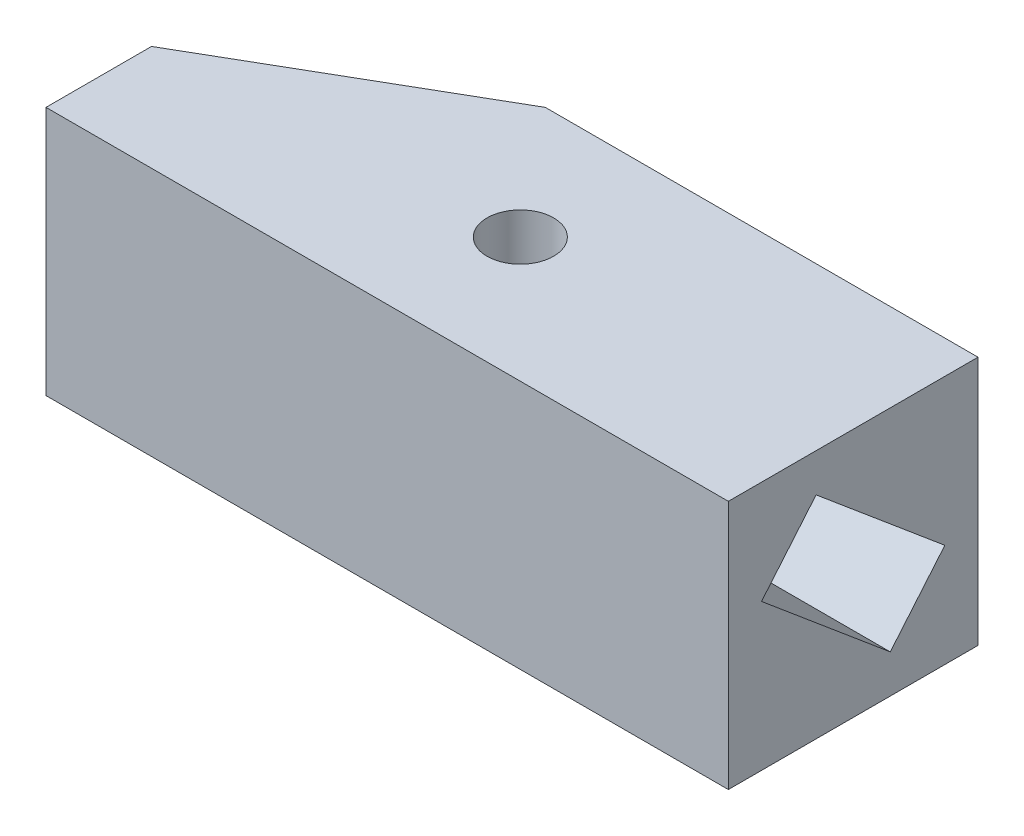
SolidWorks part; units mm, degrees
ref_plane "Спереди" through (0, 0, 0) normal (0, 0, 1) x (1, 0, 0)
ref_plane "Сверху" through (0, 0, 0) normal (0, 1, 0) x (1, 0, 0)
ref_plane "Справа" through (0, 0, 0) normal (1, 0, 0) x (0, 0, -1)
sketch "Эскиз1" plane through (0, 0, 0) normal (0, 1, 0) x (1, 0, 0)
  line L0 (-20, -15) -> (-35, -15)
  line L1 (-20, -15) -> (20, -15)
  line L2 (-35, -15) -> (-35, 15)
  line L3 (-20, 15) -> (20, 15)
  line L4 (20, -15) -> (20, 15)
  line L5 (-20, -15) -> (20, 15) construction
  line L6 (-20, 15) -> (20, -15) construction
  line L7 (-35, 15) -> (-20, 15)
  point P0 (0, 0)
  dimension "D1" = 40
  dimension "D2" = 30
  dimension "D3" = 15
extrude "Бобышка-Вытянуть1" add sketch "Эскиз1" along normal blind 30
sketch "Эскиз2" plane through (0, 30, 0) normal (0, 1, 0) x (1, 0, 0)
  line L0 (-20, -15) -> (-20, 15) construction
  circle A0 centre (-20, 0) radius 4
  dimension "D1" = 15
extrude "Вырез-Вытянуть1" cut sketch "Эскиз2" against normal through all
sketch "Эскиз5" plane through (20, 0, 0) normal (1, 0, 0) x (0, 0, -1)
  line L0 (0, 30) -> (0, 0) construction
  line L1 (-15, 30) -> (15, 0) construction
  line L2 (-15, 0) -> (15, 0) construction
  line L4 (4.4588, 4.601) -> (11.0153, 12.4147)
  line L5 (4.4588, 4.601) -> (-11.0153, 17.5853)
  line L6 (-11.0153, 17.5853) -> (-4.4588, 25.399)
  line L7 (11.0153, 12.4147) -> (-4.4588, 25.399)
  line L8 (4.4588, 4.601) -> (-4.4588, 25.399) construction
  line L9 (-11.0153, 17.5853) -> (11.0153, 12.4147) construction
  point P5 (0, 15)
  point P6 (0, 15)
  dimension "D1" = 20.2
  dimension "D2" = 10.2
  dimension "D3" = 40
extrude "Вырез-Вытянуть4" cut sketch "Эскиз5" against normal blind 25
sketch "Sketch1" plane through (-35, 0, 0) normal (-1, 0, 0) x (0, 0, 1)
  line L0 (0, 30) -> (0, 0) construction
  line L1 (-15, 30) -> (15, 30) construction
  line L3 (-15, 0) -> (15, 0)
  line L4 (-15, 0) -> (-15, 30)
  line L5 (-15, 30) -> (15, 30)
  line L6 (15, 0) -> (15, 30)
  line L7 (-15, 0) -> (15, 30) construction
  line L8 (-15, 30) -> (15, 0) construction
  point P5 (0, 15)
extrude "Boss-Extrude1" add sketch "Sketch1" along normal blind 27
chamfer "Chamfer1" distance 30 angle 30 1 edges at (-62, 15, -15)
